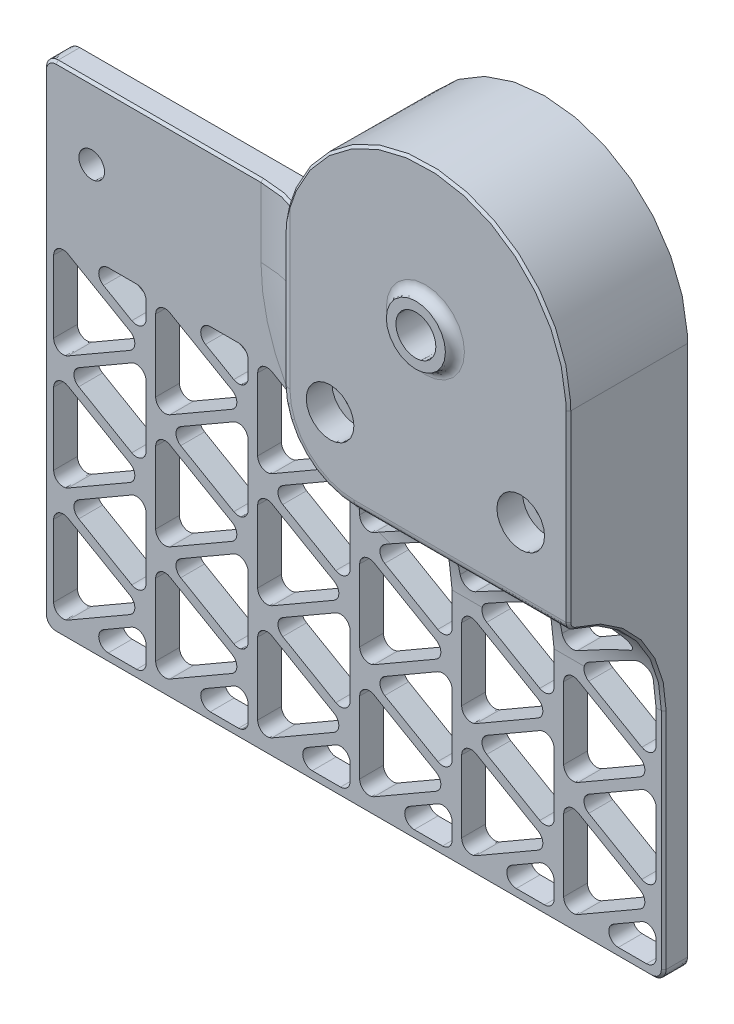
SolidWorks part; units mm, degrees
ref_plane "Płaszczyzna przednia" through (0, 0, 0) normal (0, 0, 1) x (1, 0, 0)
ref_plane "Płaszczyzna górna" through (0, 0, 0) normal (0, 1, 0) x (1, 0, 0)
ref_plane "Płaszczyzna prawa" through (0, 0, 0) normal (1, 0, 0) x (0, 0, -1)
sketch "Szkic1" plane through (0, 0, 0) normal (0, 0, 1) x (1, 0, 0)
  line L0 (0, 0) -> (0, 40)
  line L1 (0, 0) -> (60, 0)
  line L2 (60, 0) -> (60, 40)
  arc A0 (0, 40) -> (60, 40) centre (30, 40) cw
  dimension "D1" = 60
  dimension "D2" = 40
extrude "Dodanie-wyciągnięcie1" add sketch "Szkic1" along normal blind 25
sketch "Szkic2" plane through (0, 0, 25) normal (0, 0, 1) x (1, 0, 0)
  line L0 (10, 15) -> (50, 15) construction
  line L1 (30, 15) -> (30, 0) construction
  line L2 (0, 0) -> (60, 0) construction
  line L3 (0, 40) -> (0, 0) construction
  dimension "D1" = 15
  dimension "D2" = 10
hole_wizard "Pogłębienie walcowe pod M5 Wkręt z łbem walcowym z gniazdem sześciokątnym1" positions "Szkic3" profile "Szkic4" counterbore size "M5" standard "DIN"
sketch "Szkic3" plane through (0, 0, 25) normal (0, 0, 1) x (1, 0, 0)
  point P0 (10, 15)
  point P3 (50, 15)
sketch "Szkic4" plane through (10, 15, 25) normal (1, 0, 0) x (0, -1, 0)
  line L0 (0, 0) -> (0, 25)
  line L1 (0, 25) -> (2.75, 25)
  line L3 (2.75, 25) -> (2.75, 5.4)
  line L4 (2.75, 5.4) -> (5, 5.4)
  line L5 (5, 5.4) -> (5, 0)
  line L7 (5, 0) -> (0, 0)
  line L11 (0, -6.35) -> (0, 107.95) construction
  dimension "Średnica otworu na wylot" = 5.5
  dimension "Głębokość otworu na wylot" = 25
  dimension "Średnica pogłębienia walcowego" = 10
  dimension "Głębokość pogłębienia walcowego" = 5.4
hole_wizard "Otwór pod śrubę M81" positions "Szkic5" profile "Szkic6" hole size "M8" standard "DIN"
sketch "Szkic5" plane through (0, 0, 25) normal (0, 0, 1) x (1, 0, 0)
  point P0 (30, 40)
sketch "Szkic6" plane through (30, 40, 25) normal (1, 0, 0) x (0, -1, 0)
  line L0 (0, 0) -> (0, 25)
  line L1 (0, 25) -> (4.2, 25)
  line L2 (4.2, 25) -> (4.2, 0)
  line L5 (4.2, 0) -> (0, 0)
  line L11 (0, -6.35) -> (0, 107.95) construction
  dimension "Średnica otworu na wylot" = 8.4
  dimension "Głębokość otworu na wylot" = 25
sketch "Szkic7" plane through (0, 0, 0) normal (0, -1, 0) x (1, 0, 0)
  line L0 (60, 25) -> (60, 0) construction
  line L1 (0, 0) -> (60, 0)
  line L2 (0, 0) -> (0, 5)
  line L3 (0, 5) -> (60, 5)
  line L4 (60, 0) -> (60, 5)
  dimension "D1" = 5
extrude "Dodanie-wyciągnięcie2" add sketch "Szkic7" along normal blind 74
sketch "Szkic9" plane through (0, 0, 0) normal (-1, 0, 0) x (0, 0, 1)
  line L0 (0, 40) -> (0, -74) construction
  line L1 (5, -74) -> (0, -74)
  line L2 (5, -74) -> (5, 30)
  line L3 (5, 30) -> (0, 30)
  line L4 (0, -74) -> (0, 30)
  line L5 (25, 0) -> (5, 0) construction
  dimension "D1" = 30
extrude "Dodanie-wyciągnięcie3" add sketch "Szkic9" along normal blind 70
fillet "Zaokrąglenie1" radius 15 1 edges at (0, 0, 15)
fillet "Zaokrąglenie2" radius 25 3 edges at (37.5, 0, 5) (4.3934, 4.3934, 5) (0, 22.5, 5)
fillet "Zaokrąglenie3" radius 10 1 edges at (0, 30, 12.5)
fillet "Zaokrąglenie4" radius 2.5 3 edges at (60, -74, 2.5) (-70, -74, 2.5) (-70, 30, 2.5)
sketch "Szkic10" plane through (0, 0, 5) normal (0, 0, 1) x (1, 0, 0)
  line L0 (10, 15) -> (-60, 15) construction
  line L1 (-70, -71.5) -> (-70, 27.5) construction
  circle A0 centre (-60, 15) radius 2.7
  dimension "D1" = 5.4
  dimension "D2" = 10
extrude "Wytnij-wyciągnięcie2" cut sketch "Szkic10" against normal through all
sketch "Szkic12" plane through (0, 0, 0) normal (0, 0, -1) x (-1, 0, 0)
  line L1 (-30, 47.7365) -> (-36.7, 43.8682)
  line L2 (-36.7, 43.8682) -> (-36.7, 36.1318)
  line L3 (-36.7, 36.1318) -> (-30, 32.2635)
  line L4 (-30, 32.2635) -> (-23.3, 36.1318)
  line L5 (-23.3, 36.1318) -> (-23.3, 43.8682)
  line L6 (-23.3, 43.8682) -> (-30, 47.7365)
  circle A0 centre (-30, 40) radius 6.7 construction
  dimension "D1" = 13.4
extrude "Wytnij-wyciągnięcie3" cut sketch "Szkic12" against normal blind 8
chamfer "Sfazowanie1" distance 1.2 angle 65 1 edges at (25.8, 40, 8)
sketch "Szkic13" plane through (0, 0, 25) normal (0, 0, 1) x (1, 0, 0)
  circle A0 centre (30, 40) radius 6.2
  circle A1 centre (30, 40) radius 4.2 construction
  circle A2 centre (30, 40) radius 4.2
  dimension "D1" = 12.4
extrude "Dodanie-wyciągnięcie4" add sketch "Szkic13" along normal blind 2
fillet "Zaokrąglenie5" radius 2 1 edges at (23.8, 40, 25)
sketch "Szkic14" plane through (0, 0, 5) normal (0, 0, 1) x (1, 0, 0)
  line L0 (-70, 0) -> (60, 0) construction
  line L1 (-70, -71.5) -> (-70, 27.5) construction
  line L2 (60, -24.4949) -> (60, 0) construction
  line L3 (-67.5, 30) -> (-24.4949, 30) construction
  line L4 (-68, -2) -> (-68, -24)
  line L5 (-68, -24) -> (-48.9474, -13)
  line L6 (-48.9474, -13) -> (-68, -2)
  line L7 (-70, -25) -> (-36.4444, -25) construction
  line L8 (-48.9474, -37) -> (-68, -48)
  line L9 (-68, -26) -> (-48.9474, -37)
  line L10 (-68, -48) -> (-68, -26)
  line L11 (-70, -49) -> (-35.1964, -49) construction
  line L12 (-68, -50) -> (-68, -72)
  line L13 (-68, -72) -> (-48.9474, -61)
  line L14 (-48.9474, -61) -> (-68, -50)
  line L15 (57.5, -74) -> (-67.5, -74) construction
  line L16 (-46.6, -2) -> (-46.6, -24)
  line L17 (-46.6, -24) -> (-27.5474, -13)
  line L18 (-27.5474, -13) -> (-46.6, -2)
  line L19 (-27.5474, -37) -> (-46.6, -48)
  line L20 (-46.6, -26) -> (-27.5474, -37)
  line L21 (-46.6, -48) -> (-46.6, -26)
  line L22 (-46.6, -50) -> (-46.6, -72)
  line L23 (-46.6, -72) -> (-27.5474, -61)
  line L24 (-27.5474, -61) -> (-46.6, -50)
  line L25 (-25.2, -2) -> (-25.2, -24)
  line L26 (-25.2, -24) -> (-6.1474, -13)
  line L27 (-6.1474, -13) -> (-25.2, -2)
  line L28 (-6.1474, -37) -> (-25.2, -48)
  line L29 (-25.2, -26) -> (-6.1474, -37)
  line L30 (-25.2, -48) -> (-25.2, -26)
  line L31 (-25.2, -50) -> (-25.2, -72)
  line L32 (-25.2, -72) -> (-6.1474, -61)
  line L33 (-6.1474, -61) -> (-25.2, -50)
  line L34 (-3.8, -2) -> (-3.8, -24)
  line L35 (-3.8, -24) -> (15.2526, -13)
  line L36 (15.2526, -13) -> (-3.8, -2)
  line L37 (15.2526, -37) -> (-3.8, -48)
  line L38 (-3.8, -26) -> (15.2526, -37)
  line L39 (-3.8, -48) -> (-3.8, -26)
  line L40 (-3.8, -50) -> (-3.8, -72)
  line L41 (-3.8, -72) -> (15.2526, -61)
  line L42 (15.2526, -61) -> (-3.8, -50)
  line L43 (17.6, -2) -> (17.6, -24)
  line L44 (17.6, -24) -> (36.6526, -13)
  line L45 (36.6526, -13) -> (17.6, -2)
  line L46 (36.6526, -37) -> (17.6, -48)
  line L47 (17.6, -26) -> (36.6526, -37)
  line L48 (17.6, -48) -> (17.6, -26)
  line L49 (17.6, -50) -> (17.6, -72)
  line L50 (17.6, -72) -> (36.6526, -61)
  line L51 (36.6526, -61) -> (17.6, -50)
  line L52 (39, -2) -> (39, -24)
  line L53 (39, -24) -> (58.0526, -13)
  line L54 (58.0526, -13) -> (39, -2)
  line L55 (58.0526, -37) -> (39, -48)
  line L56 (39, -26) -> (58.0526, -37)
  line L57 (39, -48) -> (39, -26)
  line L58 (39, -50) -> (39, -72)
  line L59 (39, -72) -> (58.0526, -61)
  line L60 (58.0526, -61) -> (39, -50)
  dimension "D1" = 30
  dimension "D2" = 2
  dimension "D3" = 2
  dimension "D4" = 22
  dimension "D5" = 2
  dimension "D6" = 2
  dimension "D7" = 2
  dimension "D8" = 6
extrude "Wytnij-wyciągnięcie4" cut sketch "Szkic14" against normal through all both and the other way through all
sketch "Szkic15" plane through (0, 0, 5) normal (0, 0, 1) x (1, 0, 0)
  line L0 (-70, 0) -> (60, 0) construction
  line L1 (-70, -71.5) -> (-70, 27.5) construction
  line L2 (60, 0) -> (60, 40) construction
  line L3 (-67.5, 30) -> (-24.4949, 30) construction
  line L4 (-64, -2) -> (-48.6, -10.8912)
  line L5 (-48.6, -10.8912) -> (-48.6, -2)
  line L6 (-48.6, -2) -> (-64, -2)
  line L7 (-46.6, -24) -> (-46.6, -2) construction
  line L8 (-68, -2) -> (-48.9474, -13) construction
  line L12 (-48.6, -15.1088) -> (-65.7321, -25)
  line L13 (-65.7321, -25) -> (-48.6, -34.8912)
  line L14 (-48.6, -34.8912) -> (-48.6, -15.1088)
  line L15 (-48.9474, -13) -> (-68, -24) construction
  line L16 (-68, -26) -> (-48.9474, -37) construction
  line L17 (-46.6, -48) -> (-46.6, -26) construction
  line L18 (-68, -37) -> (60, -37) construction
  line L19 (-68, -48) -> (-68, -26) construction
  line L20 (60, -71.5) -> (60, -24.4949) construction
  line L21 (-48.6, -39.1088) -> (-48.6, -58.8912)
  line L22 (-65.7321, -49) -> (-48.6, -39.1088)
  line L23 (-48.6, -58.8912) -> (-65.7321, -49)
  line L24 (-48.6, -72) -> (-64, -72)
  line L25 (-48.6, -63.1088) -> (-48.6, -72)
  line L26 (-64, -72) -> (-48.6, -63.1088)
  line L27 (-42.6, -2) -> (-27.2, -10.8912)
  line L28 (-27.2, -10.8912) -> (-27.2, -2)
  line L29 (-27.2, -2) -> (-42.6, -2)
  line L30 (-27.2, -15.1088) -> (-44.3321, -25)
  line L31 (-44.3321, -25) -> (-27.2, -34.8912)
  line L32 (-27.2, -34.8912) -> (-27.2, -15.1088)
  line L33 (-27.2, -39.1088) -> (-27.2, -58.8912)
  line L34 (-44.3321, -49) -> (-27.2, -39.1088)
  line L35 (-27.2, -58.8912) -> (-44.3321, -49)
  line L36 (-27.2, -72) -> (-42.6, -72)
  line L37 (-27.2, -63.1088) -> (-27.2, -72)
  line L38 (-42.6, -72) -> (-27.2, -63.1088)
  line L39 (-21.2, -2) -> (-5.8, -10.8912)
  line L40 (-5.8, -10.8912) -> (-5.8, -2)
  line L41 (-5.8, -2) -> (-21.2, -2)
  line L42 (-5.8, -15.1088) -> (-22.9321, -25)
  line L43 (-22.9321, -25) -> (-5.8, -34.8912)
  line L44 (-5.8, -34.8912) -> (-5.8, -15.1088)
  line L45 (-5.8, -39.1088) -> (-5.8, -58.8912)
  line L46 (-22.9321, -49) -> (-5.8, -39.1088)
  line L47 (-5.8, -58.8912) -> (-22.9321, -49)
  line L48 (-5.8, -72) -> (-21.2, -72)
  line L49 (-5.8, -63.1088) -> (-5.8, -72)
  line L50 (-21.2, -72) -> (-5.8, -63.1088)
  line L51 (0.2, -2) -> (15.6, -10.8912)
  line L52 (15.6, -10.8912) -> (15.6, -2)
  line L53 (15.6, -2) -> (0.2, -2)
  line L54 (15.6, -15.1088) -> (-1.5321, -25)
  line L55 (-1.5321, -25) -> (15.6, -34.8912)
  line L56 (15.6, -34.8912) -> (15.6, -15.1088)
  line L57 (15.6, -39.1088) -> (15.6, -58.8912)
  line L58 (-1.5321, -49) -> (15.6, -39.1088)
  line L59 (15.6, -58.8912) -> (-1.5321, -49)
  line L60 (15.6, -72) -> (0.2, -72)
  line L61 (15.6, -63.1088) -> (15.6, -72)
  line L62 (0.2, -72) -> (15.6, -63.1088)
  line L63 (21.6, -2) -> (37, -10.8912)
  line L64 (37, -10.8912) -> (37, -2)
  line L65 (37, -2) -> (21.6, -2)
  line L66 (37, -15.1088) -> (19.8679, -25)
  line L67 (19.8679, -25) -> (37, -34.8912)
  line L68 (37, -34.8912) -> (37, -15.1088)
  line L69 (37, -39.1088) -> (37, -58.8912)
  line L70 (19.8679, -49) -> (37, -39.1088)
  line L71 (37, -58.8912) -> (19.8679, -49)
  line L72 (37, -72) -> (21.6, -72)
  line L73 (37, -63.1088) -> (37, -72)
  line L74 (21.6, -72) -> (37, -63.1088)
  line L75 (43, -2) -> (58.4, -10.8912)
  line L76 (58.4, -10.8912) -> (58.4, -2)
  line L77 (58.4, -2) -> (43, -2)
  line L78 (58.4, -15.1088) -> (41.2679, -25)
  line L79 (41.2679, -25) -> (58.4, -34.8912)
  line L80 (58.4, -34.8912) -> (58.4, -15.1088)
  line L81 (58.4, -39.1088) -> (58.4, -58.8912)
  line L82 (41.2679, -49) -> (58.4, -39.1088)
  line L83 (58.4, -58.8912) -> (41.2679, -49)
  line L84 (58.4, -72) -> (43, -72)
  line L85 (58.4, -63.1088) -> (58.4, -72)
  line L86 (43, -72) -> (58.4, -63.1088)
  dimension "D1" = 30
  dimension "D2" = 2
  dimension "D3" = 2
  dimension "D4" = 2
  dimension "D5" = 2
  dimension "D6" = 2
  dimension "D7" = 2
  dimension "D8" = 6
extrude "Wytnij-wyciągnięcie5" cut sketch "Szkic15" against normal through all both and the other way through all
fillet "Zaokrąglenie6" radius 2 24 edges at (43, -72, 2.5) (21.6, -72, 2.5) (0.2, -72, 2.5) (-21.2, -72, 2.5) (-42.6, -72, 2.5) (-64, -72, 2.5) (41.2679, -49, 2.5) (41.2679, -25, 2.5) (19.8679, -49, 2.5) (19.8679, -25, 2.5) (-1.5321, -49, 2.5) (-1.5321, -25, 2.5) (-22.9321, -49, 2.5) (-22.9321, -25, 2.5) (-44.3321, -25, 2.5) (-44.3321, -49, 2.5) (-65.7321, -25, 2.5) (-65.7321, -49, 2.5) (43, -2, 9.5461) (21.6, -2, 9.5461) (0.2, -2, 5.8141) (-21.2, -2, 2.5) (-42.6, -2, 2.5) (-64, -2, 2.5)
fillet "Zaokrąglenie7" radius 2 18 edges at (58.0526, -61, 2.5) (58.0526, -37, 2.5) (58.0526, -13, 3.8997) (36.6526, -13, 3.8997) (36.6526, -37, 2.5) (36.6526, -61, 2.5) (15.2526, -61, 2.5) (15.2526, -37, 2.5) (15.2526, -13, 3.8997) (-6.1474, -13, 2.6957) (-6.1474, -37, 2.5) (-6.1474, -61, 2.5) (-27.5474, -61, 2.5) (-27.5474, -37, 2.5) (-27.5474, -13, 2.5) (-48.9474, -13, 2.5) (-48.9474, -37, 2.5) (-48.9474, -61, 2.5)
fillet "Zaokrąglenie8" radius 2 18 edges at (39, -50, 2.5) (17.6, -50, 2.5) (-3.8, -50, 2.5) (-25.2, -50, 2.5) (-46.6, -50, 2.5) (-68, -50, 2.5) (-68, -26, 2.5) (-46.6, -26, 2.5) (-25.2, -26, 2.5) (39, -26, 2.5) (17.6, -26, 2.5) (-3.8, -26, 2.5) (39, -2, 9.5461) (17.6, -2, 9.5461) (-3.8, -2, 4.6944) (-25.2, -2, 2.5) (-46.6, -2, 2.5) (-68, -2, 2.5)
fillet "Zaokrąglenie9" radius 2 18 edges at (39, -24, 2.5024) (17.6, -24, 2.5024) (-3.8, -24, 2.5) (-25.2, -24, 2.5) (-46.6, -48, 2.5) (-25.2, -48, 2.5) (-3.8, -48, 2.5) (17.6, -48, 2.5) (39, -48, 2.5) (39, -72, 2.5) (17.6, -72, 2.5) (-3.8, -72, 2.5) (-25.2, -72, 2.5) (-46.6, -72, 2.5) (-68, -72, 2.5) (-68, -48, 2.5) (-46.6, -24, 2.5) (-68, -24, 2.5)
fillet "Zaokrąglenie10" radius 2 24 edges at (-48.6, -10.8912, 2.5) (-27.2, -10.8912, 2.5) (-5.8, -10.8912, 2.9013) (15.6, -10.8912, 4.5126) (37, -10.8912, 4.5126) (-48.6, -34.8912, 2.5) (-27.2, -34.8912, 2.5) (-5.8, -34.8912, 2.5) (15.6, -34.8912, 2.5) (37, -34.8912, 2.5) (37, -58.8912, 2.5) (15.6, -58.8912, 2.5) (-5.8, -58.8912, 2.5) (-27.2, -58.8912, 2.5) (-48.6, -58.8912, 2.5) (-48.6, -72, 2.5) (-27.2, -72, 2.5) (-5.8, -72, 2.5) (15.6, -72, 2.5) (37, -72, 2.5) (58.4, -72, 2.5) (58.4, -58.8912, 2.5) (58.4, -34.8912, 2.5) (58.4, -10.8912, 4.5126)
fillet "Zaokrąglenie11" radius 2 24 edges at (-48.6, -2, 2.5) (-48.6, -15.1088, 2.5) (-27.2, -2, 2.5) (-27.2, -15.1088, 2.5) (-48.6, -39.1088, 2.5) (-48.6, -63.1088, 2.5) (-27.2, -39.1088, 2.5) (-27.2, -63.1088, 2.5) (15.6, -63.1088, 2.5) (-5.8, -63.1088, 2.5) (-5.8, -39.1088, 2.5) (-5.8, -15.1088, 2.5844) (15.6, -39.1088, 2.5) (37, -39.1088, 2.5) (37, -63.1088, 2.5) (58.4, -63.1088, 2.5) (58.4, -39.1088, 2.5) (37, -15.1088, 3.4144) (15.6, -15.1088, 3.4144) (-5.8, -2, 4.2129) (15.6, -2, 9.5461) (37, -2, 9.5461) (58.4, -15.1088, 3.4144) (58.4, -2, 9.5461)
chamfer "Sfazowanie4" distance 0.5 angle 45 2 edges at (60, 20, 25) (30, 70, 25)
fillet "Zaokrąglenie13" radius 2 3 edges at (0, 25.8992, 25) (37.25, 0, 25) (4.3934, 4.3934, 25)
chamfer "Sfazowanie5" distance 0.5 angle 45 13 edges at (60, -0.1177, 24.0542) (60, -9.2804, 10.1627) (60, -47.9974, 5) (59.2678, -73.2678, 5) (-5, -74, 5) (-69.2678, -73.2678, 5) (-0.2073, 37.9744, 23.8937) (-70, -22, 5) (-4.0356, 31.9735, 15.6328) (-69.2678, 29.2678, 5) (-16.8865, 30, 6.1859) (-45.9974, 30, 5)
